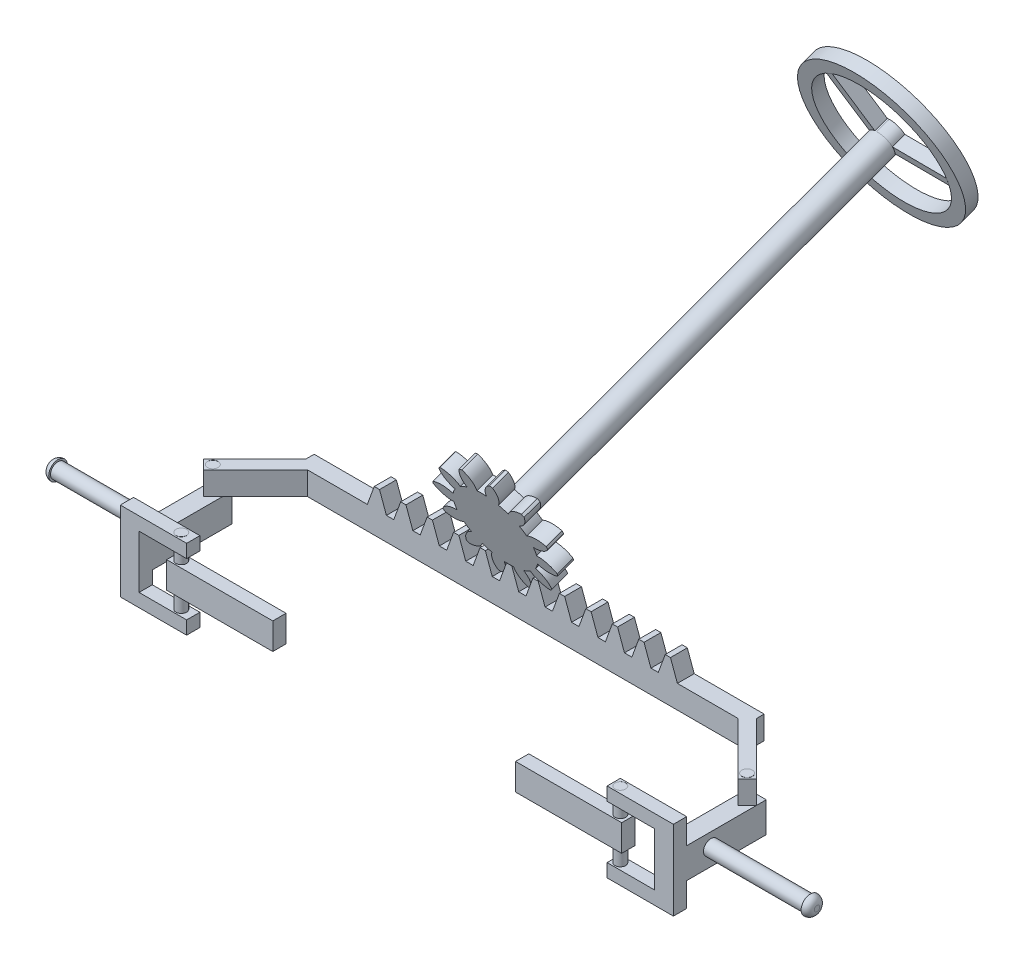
SolidWorks part; units mm, degrees
other "<rack spur rectangular_ai>-<TeethCuts>"
other "<rack spur rectangular_ai>-<TeethCuts>"
other "<spur gear_ai>-<Bore>"
ref_plane "Front Plane" through (0, 0, 0) normal (0, 0, 1) x (1, 0, 0)
ref_plane "Top Plane" through (0, 0, 0) normal (0, 1, 0) x (1, 0, 0)
ref_plane "Right Plane" through (0, 0, 0) normal (1, 0, 0) x (0, 0, -1)
inserted part "rack spur rectangular_ai"
inserted part "rack spur rectangular_ai1"
move or copy body "Body-Move/Copy1" bodies to move or copy 101 placed by mates yes
combine bodies "Combine1" operation type add bodies to combine 102 103
move or copy body "Body-Move/Copy3" bodies to move or copy 104 copy yes number of copies 1 translate (130.6024, 0, 0)
move or copy body "Body-Move/Copy4" bodies to move or copy 104 placed by mates yes
combine bodies "Combine2" operation type add bodies to combine 107 106
inserted part "spur gear_ai"
move or copy body "Body-Move/Copy6" bodies to move or copy 109 copy no rotation origin (43.3091, 0, 50.9787) rotation axis (0, 1, 0) rotation angle 90
move or copy body "Body-Move/Copy7" bodies to move or copy 111 placed by mates yes
move or copy body "Body-Move/Copy8" bodies to move or copy 112 copy no translate (-3.3614, 5.9374, 0)
move or copy body "Body-Move/Copy9" bodies to move or copy 113 copy no translate (0.2339, -4.0848, 0)
sketch "Sketch1" plane through (171.8408, 0, 0) normal (1, 0, 0) x (0, 0, -1)
  line L0 (-54.6584, 19.4069) -> (-67.3584, 19.4069) construction
  line L1 (-67.3584, 36.8694) -> (-54.6584, 36.8694)
  line L2 (-67.3584, 36.8694) -> (-67.3584, 19.4069)
  line L3 (-67.3584, 19.4069) -> (-54.6584, 19.4069)
  line L4 (-54.6584, 36.8694) -> (-54.6584, 19.4069)
  line L5 (-54.6584, 19.4069) -> (-54.6584, 36.8694) construction
extrude "Boss-Extrude1" add sketch "Sketch1" along normal blind 50
sketch "Sketch3" plane through (-67.4272, 0, 0) normal (-1, 0, 0) x (0, 0, 1)
  line L1 (54.6584, 36.8694) -> (67.3584, 36.8694)
  line L2 (54.6584, 36.8694) -> (54.6584, 19.4069)
  line L3 (54.6584, 19.4069) -> (67.3584, 19.4069)
  line L4 (67.3584, 36.8694) -> (67.3584, 19.4069)
extrude "Boss-Extrude2" add sketch "Sketch3" along normal blind 50
sketch "Sketch4" plane through (0, 0, 0) normal (0, 0, 1) x (1, 0, 0)
  line L1 (-211.4216, 61.4473) -> (-193.9616, 61.4473)
  line L2 (-211.4216, 61.4473) -> (-211.4216, 1.4473)
  line L3 (-211.4216, 1.4473) -> (-193.9616, 1.4473)
  line L4 (-193.9616, 61.4473) -> (-193.9616, 1.4473)
  dimension "D1" = 17.46
  dimension "D2" = 60
extrude "Boss-Extrude3" add sketch "Sketch4" along normal blind 10 separate body
move or copy body "Body-Move/Copy10" bodies to move or copy 117 copy no rotation origin (-202.6916, 31.4473, 0) rotation axis (0, 0, 1) rotation angle 90
move or copy body "Body-Move/Copy11" bodies to move or copy 118 placed by mates yes
move or copy body "Body-Move/Copy12" bodies to move or copy 119 copy no rotation origin (-147.4272, 0, 72.3584) rotation axis (0, 1, 0) rotation angle 45
move or copy body "Body-Move/Copy13" bodies to move or copy 120 copy no translate (16.2052, 0, 9.4712)
combine bodies "Combine3" operation type add bodies to combine 121 116
sketch "Sketch5" plane through (0, 19.4094, 0) normal (0, -1, 0) x (1, 0, 0)
  line L0 (-155.9707, 99.5073) -> (-117.4272, 60.9638) construction
  circle A0 centre (-148.9358, 99.5434) radius 4
  dimension "D2" = 8
  dimension "D1" = 5
extrude "Cut-Extrude1" cut sketch "Sketch5" against normal up to surface (17.46 mm away)
sketch "Sketch6" plane through (0, 0, 0) normal (0, 0, 1) x (1, 0, 0)
  line L7 (277.5925, 123.7764) -> (295.0525, 123.7764)
  line L8 (277.5925, 123.7764) -> (277.5925, 63.7764)
  line L9 (277.5925, 63.7764) -> (295.0525, 63.7764)
  line L10 (295.0525, 123.7764) -> (295.0525, 63.7764)
extrude "Boss-Extrude5" add sketch "Sketch6" along normal blind 10 separate body
move or copy body "Body-Move/Copy16" bodies to move or copy 127 copy no rotation origin (286.3225, 93.7764, 0) rotation axis (0, 0, 1) rotation angle 90
move or copy body "Body-Move/Copy17" bodies to move or copy 128 placed by mates yes
move or copy body "Body-Move/Copy18" bodies to move or copy 129 copy no rotation origin (251.8408, 0, 72.3584) rotation axis (0, -1, 0) rotation angle 45
move or copy body "Body-Move/Copy19" bodies to move or copy 130 copy no translate (-18.138, 0, 9.3071)
move or copy body "Body-Move/Copy20" bodies to move or copy 131 copy no translate (2.756, 0, 0.4315)
combine bodies "Combine4" operation type add bodies to combine 123 132
sketch "Sketch8" plane through (0, 36.8694, 0) normal (0, 1, 0) x (1, 0, 0)
  line L0 (254.1365, -106.8458) -> (261.2076, -99.7747) construction
  line L1 (261.2076, -99.7747) -> (221.8408, -60.4079) construction
  circle A0 centre (254.1365, -99.7747) radius 4
  dimension "D2" = 5
  dimension "D3" = 8
  dimension "D1" = 5
extrude "Cut-Extrude2" cut sketch "Sketch8" against normal up to surface (17.46 mm away)
sketch "Sketch9" plane through (0, 0, 0) normal (0, 0, 1) x (1, 0, 0)
  line L12 (-283.7333, 57.4652) -> (-283.7333, -2.5348)
  line L13 (-283.7333, -2.5348) -> (-233.7333, -2.5348)
  line L14 (-233.7333, -2.5348) -> (-233.7333, 7.4652)
  line L15 (-233.7333, 7.4652) -> (-269.5759, 7.4652)
  line L16 (-269.5759, 7.4652) -> (-269.5759, 47.4652)
  line L17 (-269.5759, 47.4652) -> (-233.7333, 47.4652)
  line L18 (-233.7333, 47.4652) -> (-233.7333, 57.4652)
  line L19 (-233.7333, 57.4652) -> (-283.7333, 57.4652)
  dimension "D1" = 10
  dimension "D2" = 10
  dimension "D3" = 60
  dimension "D4" = 50
  dimension "D5" = 50
extrude "Boss-Extrude8" add sketch "Sketch9" along normal blind 10 separate body
sketch "Sketch10" plane through (0, 57.4652, 0) normal (0, 1, 0) x (1, 0, 0)
  line L0 (-233.7333, 0) -> (-283.7333, 0) construction
  circle A0 centre (-242.7654, -5) radius 4
  dimension "D1" = 8
  dimension "D2" = 5
extrude "Cut-Extrude3" cut sketch "Sketch10" against normal up to surface (60 mm away)
move or copy body "Body-Move/Copy21" bodies to move or copy 138 copy no translate (86.4358, 0, 173.8147)
sketch "Sketch11" plane through (0, 0, 173.8147) normal (0, 0, -1) x (-1, 0, 0)
  line L0 (197.2975, 57.4652) -> (197.2975, -2.5348) construction
  line L1 (197.2975, 38.5827) -> (183.1401, 38.5827)
  line L2 (197.2975, 38.5827) -> (197.2975, 17.1856)
  line L3 (197.2975, 17.1856) -> (183.1401, 17.1856)
  line L4 (183.1401, 38.5827) -> (183.1401, 17.1856)
  line L5 (183.1401, 7.4652) -> (183.1401, 47.4652) construction
extrude "Boss-Extrude11" add sketch "Sketch11" along normal blind 60
sketch "Sketch13" plane through (0, 38.5827, 0) normal (0, 1, 0) x (1, 0, 0)
  line L0 (-197.2975, -113.8147) -> (-197.2975, -173.8147) construction
  circle A0 centre (-190.2175, -121.1362) radius 4
  dimension "D1" = 8
  dimension "D2" = 7.08
extrude "Boss-Extrude12" add sketch "Sketch13" along normal blind 17.46 contours A0
move or copy body "Body-Move/Copy26" bodies to move or copy 147 placed by mates yes
move or copy body "Body-Move/Copy27" bodies to move or copy 148 copy no translate (0, -17.5079, 0)
move or copy body "Body-Move/Copy28" bodies to move or copy 149 copy no translate (0, -1.7552, 0)
sketch "Sketch15" plane through (0, 0, 0) normal (0, 0, 1) x (1, 0, 0)
  line L0 (307.3628, 204.0038) -> (307.3628, 144.0038)
  line L1 (307.3628, 144.0038) -> (357.3628, 144.0038)
  line L2 (357.3628, 144.0038) -> (357.3628, 154.0038)
  line L3 (357.3628, 154.0038) -> (321.5202, 154.0038)
  line L4 (321.5202, 154.0038) -> (321.5202, 194.0038)
  line L5 (321.5202, 194.0038) -> (357.3628, 194.0038)
  line L6 (357.3628, 194.0038) -> (357.3628, 204.0038)
  line L7 (357.3628, 204.0038) -> (307.3628, 204.0038)
  dimension "D1" = 50
extrude "Boss-Extrude13" add sketch "Sketch15" along normal blind 10 separate body
move or copy body "Body-Move/Copy29" bodies to move or copy 151 copy no rotation origin (332.3628, 0, 5) rotation axis (0, 1, 0) rotation angle 180
sketch "Sketch16" plane through (0, 0, 0) normal (0, 0, -1) x (-1, 0, 0)
  line L0 (-357.3628, 204.0038) -> (-357.3628, 144.0038) construction
  line L1 (-357.3628, 185.007) -> (-343.2055, 185.007)
  line L2 (-357.3628, 185.007) -> (-357.3628, 162.1978)
  line L3 (-357.3628, 162.1978) -> (-343.2055, 162.1978)
  line L4 (-343.2055, 185.007) -> (-343.2055, 162.1978)
  line L5 (-343.2055, 154.0038) -> (-343.2055, 194.0038) construction
extrude "Boss-Extrude14" add sketch "Sketch16" along normal blind 60
sketch "Sketch17" plane through (0, 204.0038, 0) normal (0, 1, 0) x (1, 0, 0)
  line L0 (307.3628, -10) -> (357.3628, -10) construction
  line L1 (307.3628, 0) -> (307.3628, -10) construction
  circle A0 centre (312.3628, -5) radius 4
  dimension "D1" = 8
  dimension "D2" = 5
  dimension "D3" = 5
extrude "Cut-Extrude4" cut sketch "Sketch17" against normal up to surface (60 mm away) contours A0
sketch "Sketch18" plane through (0, 185.007, 0) normal (0, 1, 0) x (1, 0, 0)
  line L0 (343.2055, 60) -> (343.2055, 0) construction
  line L1 (343.2055, 60) -> (357.3628, 60) construction
  circle A0 centre (350.2855, 52.68) radius 4
  dimension "D1" = 8
  dimension "D2" = 7.08
  dimension "D3" = 7.32
extrude "Boss-Extrude16" add sketch "Sketch18" along normal blind 17.48
move or copy body "Body-Move/Copy31" bodies to move or copy 157 placed by mates yes
move or copy body "Body-Move/Copy32" bodies to move or copy 158 copy no translate (0, -165.5112, 0)
ref_plane "Plane3" through (-106.0158, 38.2021, 162.2219) normal (0, 0, -1) x (-1, 0, 0)
sketch "Sketch19" plane through (-106.0158, 38.2021, 162.2219) normal (0, 0, -1) x (-1, 0, 0)
  circle A0 centre (215.383, 60.8698) radius 4
  dimension "D1" = 8
extrude "Boss-Extrude17" add sketch "Sketch19" along normal blind 60 separate body
move or copy body "Body-Move/Copy33" bodies to move or copy 160 copy yes number of copies 1 translate (17.0899, 0, 0)
move or copy body "Body-Move/Copy34" bodies to move or copy 160 copy no rotation origin (0, 99.0719, 132.2219) rotation axis (1, 0, 0) rotation angle 90
move or copy body "Body-Move/Copy35" bodies to move or copy 162 placed by mates yes
move or copy body "Body-Move/Copy36" bodies to move or copy 163 copy no translate (0, -90.7246, 0)
move or copy body "Body-Move/Copy37" bodies to move or copy 161 copy no rotation origin (0, 99.0719, 132.2219) rotation axis (1, 0, 0) rotation angle 90
move or copy body "Body-Move/Copy38" bodies to move or copy 165 placed by mates yes
move or copy body "Body-Move/Copy39" bodies to move or copy 166 copy no translate (0, -90.6113, 0)
sketch "Sketch20" plane through (0, 0, 0) normal (0, 0, 1) x (1, 0, 0)
  line L1 (-378.9964, 70.0159) -> (-348.9964, 70.0159)
  line L2 (-378.9964, 70.0159) -> (-378.9964, 50.0159)
  line L3 (-378.9964, 50.0159) -> (-348.9964, 50.0159)
  line L4 (-348.9964, 70.0159) -> (-348.9964, 50.0159)
  dimension "D1" = 30
  dimension "D2" = 20
extrude "Boss-Extrude18" add sketch "Sketch20" along normal blind 10 separate body
sketch "Sketch21" plane through (0, 70.0159, 0) normal (0, 1, 0) x (1, 0, 0)
  line L0 (-378.9964, -10) -> (-378.9964, 0) construction
  line L1 (-348.9964, 0) -> (-378.9964, 0) construction
  circle A0 centre (-372.9964, -5) radius 4
  dimension "D1" = 8
  dimension "D2" = 6
  dimension "D3" = 5
extrude "Cut-Extrude5" cut sketch "Sketch21" against normal up to surface (20 mm away)
move or copy body "Body-Move/Copy40" bodies to move or copy 169 placed by mates yes
move or copy body "Body-Move/Copy41" bodies to move or copy 170 copy no translate (0, -50, 0)
move or copy body "Body-Move/Copy42" bodies to move or copy 171 copy yes number of copies 1 translate (66.7575, 0, 0)
move or copy body "Body-Move/Copy43" bodies to move or copy 172 copy no rotation origin (-39.2904, 0, 157.2219) rotation axis (0, 1, 0) rotation angle 180
move or copy body "Body-Move/Copy44" bodies to move or copy 173 placed by mates yes
sketch "Sketch22" plane through (-91.0478, 0, 0) normal (1, 0, 0) x (0, 0, -1)
  line L1 (-162.2219, 20.0159) -> (-152.2219, 20.0159)
  line L2 (-162.2219, 20.0159) -> (-162.2219, 0.0159)
  line L3 (-162.2219, 0.0159) -> (-152.2219, 0.0159)
  line L4 (-152.2219, 20.0159) -> (-152.2219, 0.0159)
extrude "Boss-Extrude19" add sketch "Sketch22" along normal blind 50
sketch "Sketch23" plane through (192.2139, 0, 0) normal (-1, 0, 0) x (0, 0, 1)
  line L1 (152.4547, 20.0159) -> (162.4547, 20.0159)
  line L2 (152.4547, 20.0159) -> (152.4547, 0.0159)
  line L3 (152.4547, 0.0159) -> (162.4547, 0.0159)
  line L4 (162.4547, 20.0159) -> (162.4547, 0.0159)
extrude "Boss-Extrude20" add sketch "Sketch23" along normal blind 50
move or copy body "Body-Move/Copy45" bodies to move or copy 114 copy no rotation origin (0, 81.9356, 61.0084) rotation axis (1, 0, 0) rotation angle 20
move or copy body "Body-Move/Copy46" bodies to move or copy 177 copy no translate (0, 0, 10.9208)
sketch "Sketch25" plane through (0, -15.7048, 43.1486) normal (0, -0.342, 0.9397) x (1, 0, 0)
  circle A0 centre (42.3855, 101.5956) radius 9.525
extrude "Boss-Extrude21" add sketch "Sketch25" against normal blind 310
scale "Scale3" bodies to scale 159 150 164 179 176 175 167 135 scale about origin uniform scaling yes scale factor 1
scale "Scale4" bodies to scale 199 196 201 198 200 203 197 202 scale about origin uniform scaling yes scale factor 2
sketch "Sketch26" plane through (-312.0315, 0, 0) normal (-1, 0, 0) x (0, 0, 1)
  circle A0 centre (268.3393, 18.7337) radius 11.25
  dimension "D1" = 22.5
extrude "Boss-Extrude22" add sketch "Sketch26" along normal blind 150
sketch3d "3DSketch1"
  line L0 (-462.0315, 18.7337, 268.3393) -> (-312.0315, 18.7337, 268.3393) construction
  circle A0 centre (-312.0315, 18.7337, 268.3393) radius 11.25
  circle A1 centre (-312.0315, 18.7337, 268.3393) radius 11.25
  circle A2 centre (-312.0315, 18.7337, 268.3393) radius 11.25
  point P2 (-300.7815, 18.7337, 268.3393)
  point P6 (-300.7815, 18.7337, 268.3393)
  point P8 (-300.7815, 18.7337, 268.3393)
sketch "Sketch28" plane through (522.4278, 0, 0) normal (1, 0, 0) x (0, 0, -1)
  circle A0 centre (-268.3393, 18.7337) radius 11.25
extrude "Boss-Extrude23" add sketch "Sketch28" along normal blind 150
sketch "Sketch30" plane through (-462.0315, 0, 0) normal (-1, 0, 0) x (0, 0, 1)
  circle A1 centre (268.3393, 18.7337) radius 14
  dimension "D1" = 28
extrude "Boss-Extrude26" add sketch "Sketch30" along normal blind 10
fillet "Fillet2" radius 10 1 edges at (-472.0315, 18.7337, 282.3393)
sketch "Sketch31" plane through (672.4278, 0, 0) normal (1, 0, 0) x (0, 0, -1)
  circle A0 centre (-268.3393, 18.7337) radius 14
  dimension "D1" = 28
extrude "Boss-Extrude27" add sketch "Sketch31" along normal blind 10
fillet "Fillet3" radius 10 1 edges at (682.4278, 18.7337, 254.3393)
sketch "Sketch33" plane through (0, 180.6429, -496.3123) normal (0, 0.342, -0.9397) x (-1, 0, 0)
  line L2 (-70.3436, 215.9548) -> (-30.2542, 286.8083)
  line L4 (-80.7877, 221.8642) -> (-40.6983, 292.7176)
  line L5 (-102.6332, 196.9359) -> (-184.0388, 196.2275)
  line L6 (-40.6983, 292.7176) -> (-30.2542, 286.8083)
  line L8 (-102.7376, 208.9354) -> (-184.1432, 208.2271)
  line L9 (-184.1432, 208.2271) -> (-184.0388, 196.2275)
  line L12 (-70.1219, 190.4813) -> (-28.8057, 120.3361)
  line L14 (-80.4616, 184.3911) -> (-39.1454, 114.2459)
  line L15 (-39.1454, 114.2459) -> (-28.8057, 120.3361)
  circle A0 centre (-84.5143, 203.0938) radius 19.1367
  circle A1 centre (-84.5143, 203.0938) radius 120
  circle A2 centre (-84.5143, 203.0938) radius 99.7611
  dimension "D1" = 12
  dimension "D3" = 12
  dimension "D4" = 12
  dimension "D8" = 120
  dimension "D11" = 120
  dimension "D12" = 120
extrude "Boss-Extrude29" add sketch "Sketch33" along normal blind 20 contours A1 A2 | A0 L2 L6 L4 | L8 L9 L5 M12 | A0 L14 L15 L12 | A0 M12
